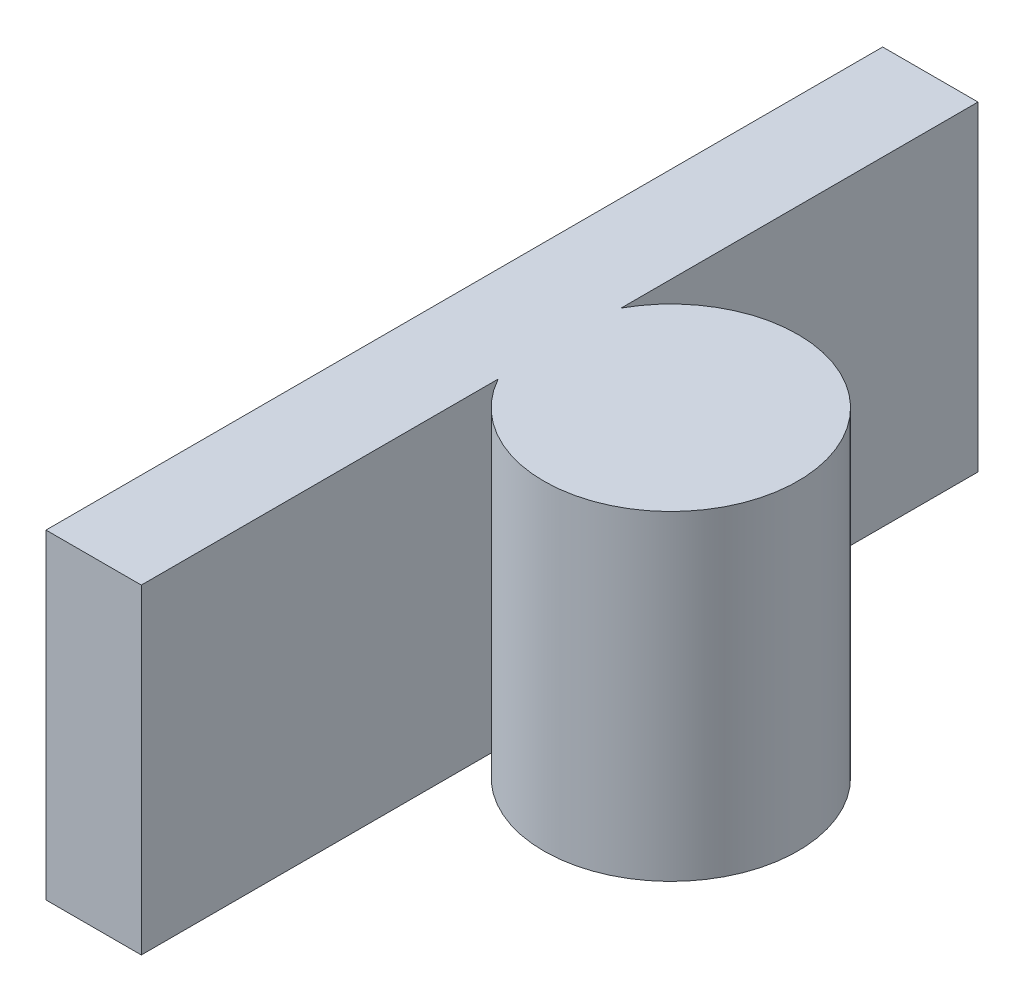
SolidWorks part; units mm, degrees
ref_plane "Plan de face" through (0, 0, 0) normal (0, 0, 1) x (1, 0, 0)
ref_plane "Plan de dessus" through (0, 0, 0) normal (0, 1, 0) x (1, 0, 0)
ref_plane "Plan de droite" through (0, 0, 0) normal (1, 0, 0) x (0, 0, -1)
sketch "Esquisse1" plane through (0, 0, 0) normal (0, 1, 0) x (1, 0, 0)
  line L0 (27.4445, -6.7756) -> (27.4445, -19.7756) construction
  line L1 (27.4445, 12.2244) -> (23.4445, 12.2244) construction
  line L2 (27.4445, 12.2244) -> (27.4445, -0.7756) construction
  line L3 (27.4445, -19.7756) -> (23.4445, -19.7756) construction
  line L4 (23.4445, 12.2244) -> (23.4445, -19.7756) construction
  line L5 (27.2445, -6.0994) -> (27.2445, -19.5756)
  line L6 (27.2445, -19.5756) -> (23.6445, -19.5756)
  line L7 (23.6445, 12.0244) -> (23.6445, -19.5756)
  line L8 (27.2445, 12.0244) -> (23.6445, 12.0244)
  line L9 (27.2445, 12.0244) -> (27.2445, -1.4518)
  arc A0 (27.4445, -6.7756) -> (27.4445, -0.7756) centre (31.4445, -3.7756) ccw construction
  arc A1 (27.2445, -6.0994) -> (27.2445, -1.4518) centre (31.4445, -3.7756) ccw
  dimension "D1" = 4
  dimension "D2" = 32
  dimension "D3" = 0.2
extrude "Boss.-Extru.1" add sketch "Esquisse1" along normal blind 12.1
